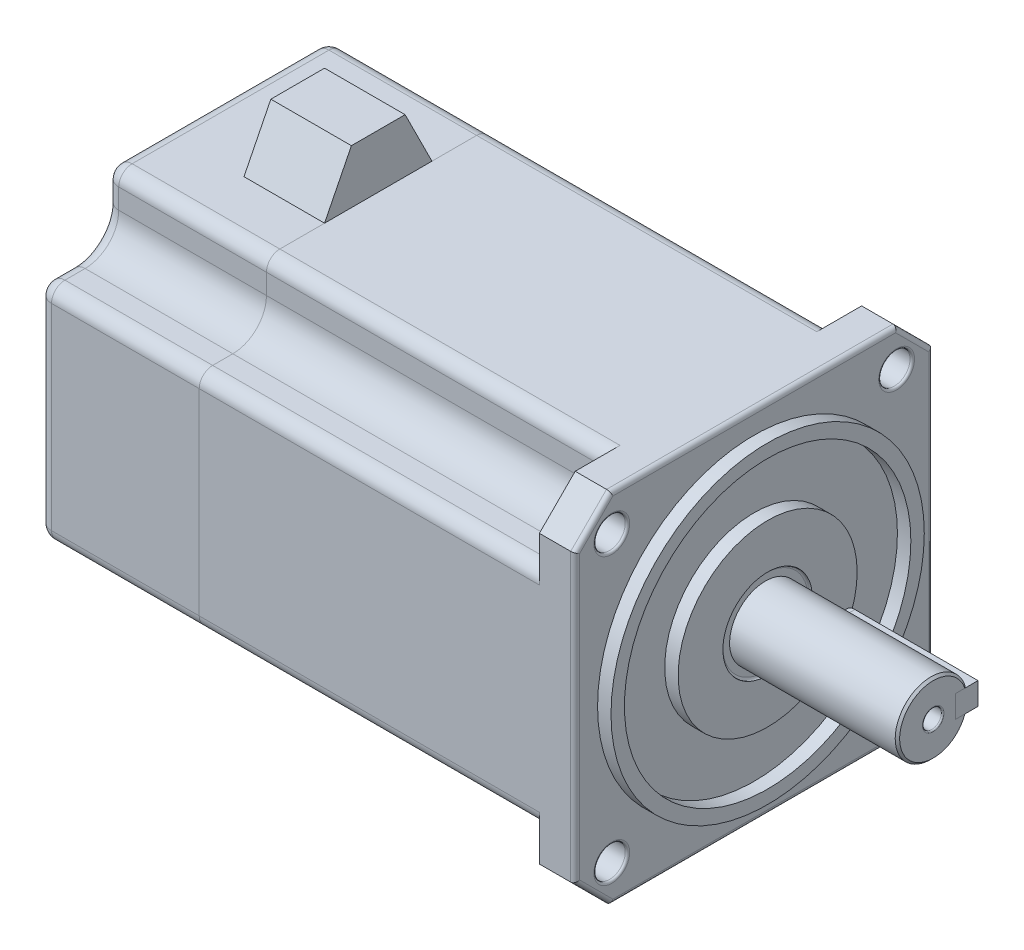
SolidWorks part; units mm, degrees
ref_plane "前视基准面" through (0, 0, 0) normal (0, 0, 1) x (1, 0, 0)
ref_plane "上视基准面" through (0, 0, 0) normal (0, 1, 0) x (1, 0, 0)
ref_plane "右视基准面" through (0, 0, 0) normal (1, 0, 0) x (0, 0, -1)
sketch "草图1" plane through (0, 0, 0) normal (1, 0, 0) x (0, 0, -1)
  line L0 (-40, 32) -> (-32, 40)
  line L1 (-32, -40) -> (32, -40)
  line L2 (-40, -32) -> (-40, 32)
  line L3 (-32, 40) -> (32, 40)
  line L4 (40, -32) -> (40, 32)
  line L5 (-40, -40) -> (40, 40) construction
  line L6 (-40, 40) -> (40, -40) construction
  line L7 (32, 40) -> (40, 32)
  line L8 (32, -40) -> (40, -32)
  line L9 (-40, -32) -> (-32, -40)
  point P0 (0, 0)
extrude "凸台-拉伸1" add sketch "草图1" against normal blind 84
sketch "草图2" plane through (-84, 0, 0) normal (-1, 0, 0) x (0, 0, 1)
  line L0 (-32, 40) -> (32, 40) construction
  line L1 (-32, -40) -> (32, -40)
  line L2 (-40, -32) -> (-40, 32)
  line L3 (-32, 40) -> (32, 40)
  line L4 (40, -32) -> (40, 32)
  line L5 (-40, -40) -> (40, 40) construction
  line L6 (-40, 40) -> (40, -40) construction
  line L7 (-40, 32) -> (-32, 40)
  line L8 (-32, -40) -> (-40, -32)
  line L9 (32, -40) -> (40, -32)
  line L10 (40, 32) -> (32, 40)
  point P0 (0, 0)
extrude "凸台-拉伸2" add sketch "草图2" along normal blind 36 separate body
sketch "草图3" plane through (-120, 0, 0) normal (-1, 0, 0) x (0, 0, 1)
  line L0 (-32.5, 24.9834) -> (-37, 24.9834)
  line L1 (-40, 32) -> (-40, -32) construction
  line L3 (-37, -24.9834) -> (-32.5, -24.9834)
  line L4 (-40, 21.9834) -> (-40, 32)
  line L5 (-24.9834, -32.5) -> (-24.9834, -37)
  line L6 (-32, -40) -> (32, -40) construction
  line L8 (24.9834, -37) -> (24.9834, -32.5)
  line L9 (-40, 32) -> (-32, 40)
  line L10 (32.5, -24.9834) -> (37, -24.9834)
  line L11 (40, -32) -> (40, 32) construction
  line L13 (37, 24.9834) -> (32.5, 24.9834)
  line L14 (-32, 40) -> (-21.9834, 40)
  line L15 (24.9834, 32.5) -> (24.9834, 37)
  line L16 (32, 40) -> (-32, 40) construction
  line L18 (-24.9834, 37) -> (-24.9834, 32.5)
  line L19 (21.9834, 40) -> (32, 40)
  line L20 (32, 40) -> (40, 32)
  line L21 (40, 32) -> (40, 21.9834)
  line L22 (40, -21.9834) -> (40, -32)
  line L23 (40, -32) -> (32, -40)
  line L24 (32, -40) -> (40, -32) construction
  line L25 (32, -40) -> (21.9834, -40)
  line L26 (-21.9834, -40) -> (-32, -40)
  line L27 (-32, -40) -> (-40, -32)
  line L28 (-40, -32) -> (-40, -21.9834)
  arc A0 (-32.5, 24.9834) -> (-24.9834, 32.5) centre (-32.5, 32.5) ccw
  arc A1 (24.9834, 32.5) -> (32.5, 24.9834) centre (32.5, 32.5) ccw
  arc A2 (32.5, -24.9834) -> (24.9834, -32.5) centre (32.5, -32.5) ccw
  arc A3 (-24.9834, -32.5) -> (-32.5, -24.9834) centre (-32.5, -32.5) ccw
  arc A4 (-40, 21.9834) -> (-37, 24.9834) centre (-37, 21.9834) cw
  arc A5 (-21.9834, 40) -> (-24.9834, 37) centre (-21.9834, 37) ccw
  arc A6 (21.9834, 40) -> (24.9834, 37) centre (21.9834, 37) cw
  arc A7 (37, 24.9834) -> (40, 21.9834) centre (37, 21.9834) cw
  arc A8 (40, -21.9834) -> (37, -24.9834) centre (37, -21.9834) cw
  arc A9 (24.9834, -37) -> (21.9834, -40) centre (21.9834, -37) cw
  arc A10 (-21.9834, -40) -> (-24.9834, -37) centre (-21.9834, -37) cw
  arc A11 (-37, -24.9834) -> (-40, -21.9834) centre (-37, -21.9834) cw
  point P0 (0, 0)
  point P10 (-40, 24.9834)
  point P38 (-24.9834, 40)
  point P41 (24.9834, 40)
  point P44 (40, 24.9834)
  point P47 (40, -24.9834)
  point P50 (24.9834, -40)
  point P53 (-24.9834, -40)
  point P56 (-40, -24.9834)
  dimension "D1" = 3
extrude "切除-拉伸1" cut sketch "草图3" against normal blind 112
sketch "草图4" plane through (0, 0, 0) normal (1, 0, 0) x (0, 0, -1)
  circle A1 centre (-31.8198, -31.8198) radius 3.5
  circle A2 centre (31.8198, -31.8198) radius 3.5
  circle A3 centre (31.8198, 31.8198) radius 3.5
  circle A4 centre (-31.8198, 31.8198) radius 3.5
extrude "切除-拉伸2" cut sketch "草图4" against normal blind 8
fillet "圆角1" radius 3 24 edges at (-120, 24.9834, -34.75) (-120, 27.1849, -27.1849) (-120, 34.75, -24.9834) (-120, 39.1213, -24.1047) (-120, 40, 0) (-120, 39.1213, 24.1047) (-120, 34.75, 24.9834) (-120, 27.1849, 27.1849) (-120, 24.9834, 34.75) (-120, 24.1047, 39.1213) (-120, 0, 40) (-120, -24.1047, 39.1213) (-120, -24.9834, 34.75) (-120, -27.1849, 27.1849) (-120, -34.75, 24.9834) (-120, -39.1213, 24.1047) (-120, -40, 0) (-120, -39.1213, -24.1047) (-120, -34.75, -24.9834) (-120, -27.1849, -27.1849) (-120, -24.9834, -34.75) (-120, -24.1047, -39.1213) (-120, 0, -40) (-120, 24.1047, -39.1213)
fillet "圆角2" radius 1 8 edges at (0, 36, -36) (0, 0, -40) (0, -36, -36) (0, -40, 0) (0, -36, 36) (0, 0, 40) (0, 36, 36) (0, 40, 0)
sketch "草图5" plane through (0, 0, 0) normal (1, 0, 0) x (0, 0, -1)
  circle A0 centre (0, 0) radius 35
  circle A1 centre (0, 0) radius 32
extrude "凸台-拉伸3" add sketch "草图5" along normal blind 3 separate body
sketch "草图6" plane through (0, 0, 0) normal (1, 0, 0) x (0, 0, -1)
  circle A0 centre (0, 0) radius 20
extrude "凸台-拉伸4" add sketch "草图6" along normal blind 3
sketch "草图7" plane through (3, 0, 0) normal (1, 0, 0) x (0, 0, -1)
  circle A0 centre (0, 0) radius 10
extrude "切除-拉伸3" cut sketch "草图7" against normal blind 0.5
fillet "圆角3" radius 0.5 1 edges at (2.5, 0, -10)
sketch "草图8" plane through (2.5, 0, 0) normal (1, 0, 0) x (0, 0, -1)
  circle A0 centre (0, 0) radius 8
extrude "凸台-拉伸5" add sketch "草图8" along normal blind 37.5
ref_plane "基准面1" through (0, 0, -8) normal (0, 0, 1) x (1, 0, 0)
chamfer "倒角1" distance 0.5 angle 45 1 edges at (40, 0, -8)
sketch "草图18" plane through (0, 0, -8) normal (0, 0, 1) x (1, 0, 0)
  line L1 (40, -7.5) -> (40, 7.5) construction
  line L2 (12.5, 2.5) -> (40, 2.5)
  line L3 (40, 2.5) -> (40, -2.5)
  line L4 (40, -2.5) -> (12.5, -2.5)
  arc A0 (12.5, 2.5) -> (12.5, -2.5) centre (12.5, 0) ccw
sketch "草图21" plane through (0, 40, 0) normal (0, 1, 0) x (1, 0, 0)
  line L3 (-102, -12) -> (-84, -12)
  line L4 (-102, -12) -> (-102, 12)
  line L5 (-102, 12) -> (-84, 12)
  line L6 (-84, -12) -> (-84, 12)
  line L7 (-102, -12) -> (-84, 12) construction
  line L8 (-102, 12) -> (-84, -12) construction
extrude "凸台-拉伸9" add sketch "草图21" along normal blind 12 separate body
sketch "草图22" plane through (-84, 0, 0) normal (1, 0, 0) x (0, 0, -1)
  line L0 (-12, 40) -> (-12, 52)
  line L1 (-12, 52) -> (-6, 52)
  line L2 (-12, 52) -> (12, 52) construction
  line L3 (12, 40) -> (12, 52)
  line L4 (12, 52) -> (6, 52)
  line L5 (-6, 52) -> (-12, 40)
  line L6 (6, 52) -> (12, 40)
extrude "切除-拉伸10" cut sketch "草图22" against normal blind 18
extrude "切除-拉伸9" cut sketch "草图18" along normal blind 3
sketch "草图19" plane through (0, 0, -5) normal (0, 0, -1) x (-1, 0, 0)
  line L0 (-12.5, 2.5) -> (-40, 2.5)
  line L1 (-40, 2.5) -> (-40, -2.5)
  line L2 (-40, -2.5) -> (-12.5, -2.5)
  arc A0 (-12.5, -2.5) -> (-12.5, 2.5) centre (-12.5, 0) ccw
extrude "凸台-拉伸8" add sketch "草图19" along normal blind 5 separate body
hole_wizard "M5 螺纹孔1" positions "草图15" profile "草图14" tap size "M5" standard "GB"
sketch "草图15" plane through (40, 0, 0) normal (1, 0, 0) x (0, 0, -1)
  point P0 (0, 0)
sketch "草图14" plane through (40, 0, 0) normal (0, 1, 0) x (0, 0, -1)
  line L0 (0, 0) -> (0, 9.2618)
  line L1 (0, 9.2618) -> (2.1, 8)
  line L2 (2.1, 8) -> (2.1, 0)
  line L5 (2.1, 0) -> (0, 0)
  line L10 (0, 9.2618) -> (-2.1, 8) construction
  line L11 (0, -6.35) -> (0, 107.95) construction
  dimension "螺纹孔钻头直径" = 4.2
  dimension "螺纹孔钻头深度" = 8
  dimension "导头角度" = 118
fillet "圆角4" radius 0.5 4 edges at (0, -31.8198, 28.3198) (0, -31.8198, -35.3198) (0, 31.8198, -35.3198) (0, 31.8198, 28.3198)
fillet "圆角5" radius 0.3 1 edges at (40, 0, -2.1)
